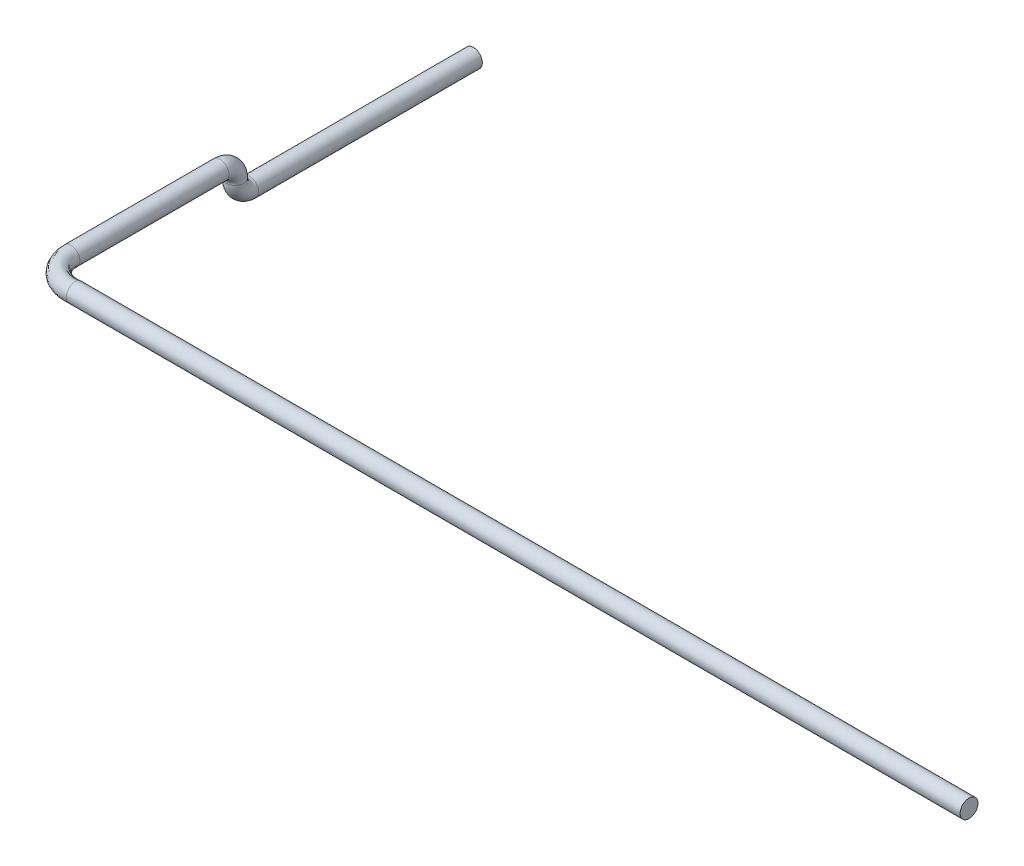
SolidWorks part; units mm, degrees
ref_plane "Front Plane" through (0, 0, 0) normal (0, 0, 1) x (1, 0, 0)
ref_plane "Top Plane" through (0, 0, 0) normal (0, 1, 0) x (1, 0, 0)
ref_plane "Right Plane" through (0, 0, 0) normal (1, 0, 0) x (0, 0, -1)
sketch "Sketch1" plane through (0, 0, 0) normal (0, 0, 1) x (1, 0, 0)
  circle A1 centre (-38.1, 50.8) radius 3.81
sketch "Sketch2" plane through (0, 50.8, 0) normal (0, 1, 0) x (-1, 0, 0)
  line L0 (38.1, 0) -> (38.1, 88.9)
  dimension "D1" = 88.9
sweep "Sweep1" add profiles "Sketch1" path "Sketch2"
ref_plane "Plane2" through (-38.1, 0, 0) normal (1, 0, 0) x (0, 0, -1)
sketch "Sketch3" plane through (-38.1, 0, 0) normal (1, 0, 0) x (0, 0, -1)
  line L0 (-88.9, 50.8) -> (-95.25, 50.8)
  line L1 (-88.9, 54.61) -> (-88.9, 46.99) construction
  line L2 (-107.95, 63.5) -> (-165.1, 63.5)
  arc A0 (-95.25, 50.8) -> (-101.6, 57.15) centre (-95.25, 57.15) cw
  arc A1 (-101.6, 57.15) -> (-107.95, 63.5) centre (-107.95, 57.15) ccw
  dimension "D2" = 6.35
  dimension "D1" = 6.35
  dimension "D3" = 57.15
sketch "Sketch4" plane through (0, 0, 88.9) normal (0, 0, 1) x (1, 0, 0)
  circle A0 centre (-38.1, 50.8) radius 3.81 construction
  circle A1 centre (-38.1, 50.8) radius 3.81
sweep "Sweep2" add profiles "Sketch4" path "Sketch3"
ref_plane "Plane3" through (0, 63.5, 0) normal (0, 1, 0) x (-1, 0, 0)
sketch "Sketch5" plane through (0, 63.5, 0) normal (0, 1, 0) x (-1, 0, 0)
  line L0 (38.1, 165.1) -> (38.1, 171.45)
  line L1 (41.91, 165.1) -> (34.29, 165.1) construction
  line L2 (23.8823, 184.059) -> (-357.1177, 184.059)
  arc A0 (38.1, 171.45) -> (23.8823, 184.059) centre (25.4, 171.45) ccw
  dimension "D2" = 12.7
  dimension "D1" = 6.35
  dimension "D3" = 381
sketch "Sketch6" plane through (0, 0, 165.1) normal (0, 0, 1) x (1, 0, 0)
  circle A1 centre (-38.1, 63.5) radius 3.81
  circle A2 centre (-38.1, 63.5) radius 3.81
  dimension "D1" = 0
sweep "Sweep3" add profiles "Sketch6" path "Sketch5"
